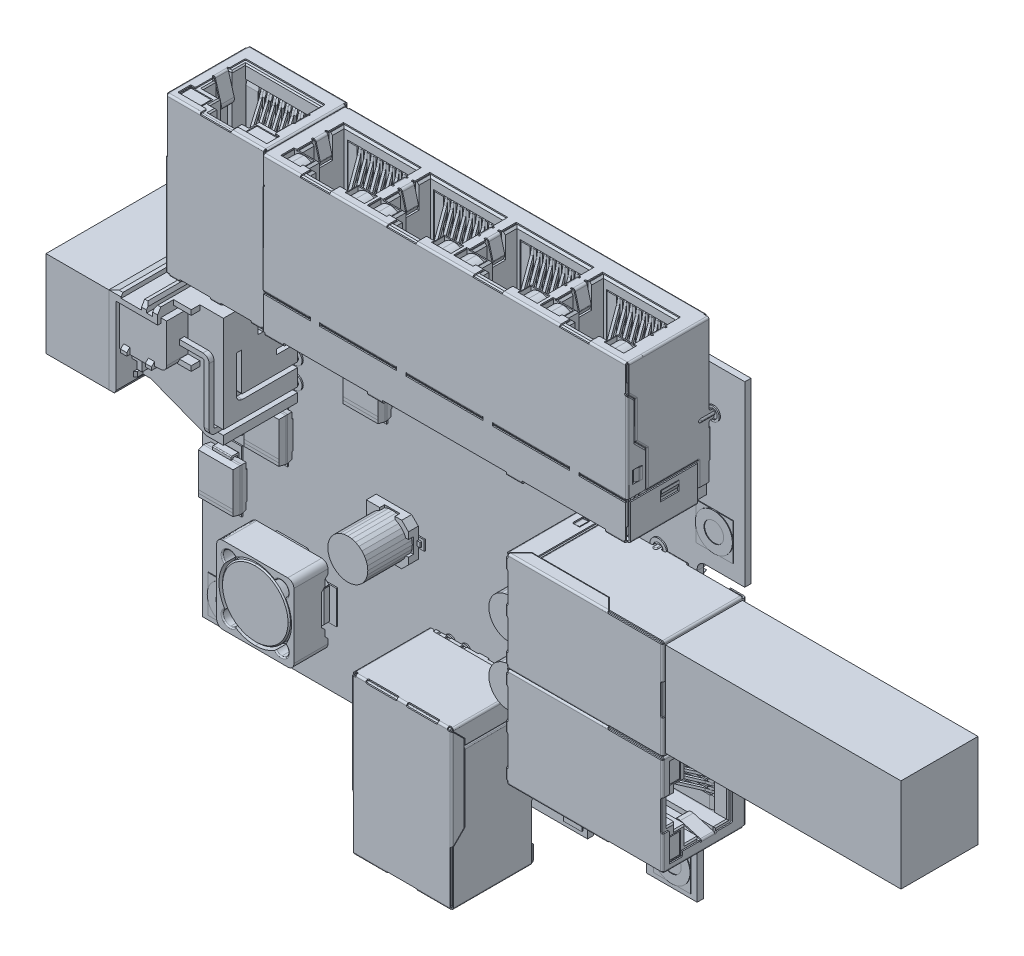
SolidWorks part; units mm, degrees
other "1[1]"
other "2[1]"
other "3[1]"
other "4[1]"
other "5[1]"
other "6[1]"
other "7[1]"
other "8[1]"
other "9[1]"
other "10[1]"
other "11[1]"
other "12[1]"
other "13[1]"
other "14[1]"
other "15[1]"
other "16[1]"
other "17[1]"
other "18[1]"
other "19[1]"
other "20[1]"
other "21[1]"
other "22[1]"
other "23[1]"
other "24[1]"
other "25[1]"
other "26[1]"
other "27[1]"
other "28[1]"
other "29[1]"
other "30[1]"
other "31[1]"
other "32[1]"
other "33[1]"
other "34[1]"
other "35[1]"
other "36[1]"
other "37[1]"
other "38[1]"
other "39[1]"
other "40[1]"
other "41[1]"
other "42[1]"
other "43[1]"
other "44[1]"
other "45[1]"
other "46[1]"
other "47[1]"
other "48[1]"
other "49[1]"
other "50[1]"
other "51[1]"
other "52[1]"
other "53[1]"
other "54[1]"
other "55[1]"
other "56[1]"
other "57[1]"
other "58[1]"
other "59[1]"
other "60[1]"
other "61[1]"
other "62[1]"
other "63[1]"
other "64[1]"
other "65[1]"
other "66[1]"
other "67[1]"
other "68[1]"
other "69[1]"
other "70[1]"
other "71[1]"
other "72[1]"
other "73[1]"
other "74[1]"
other "75[1]"
other "76[1]"
other "77[1]"
other "78[1]"
other "79[1]"
other "80[1]"
other "81[1]"
other "82[1]"
other "83[1]"
other "84[1]"
other "85[1]"
other "86[1]"
other "87[1]"
other "88[1]"
other "89[1]"
other "90[1]"
other "91[1]"
other "92[1]"
other "93[1]"
other "94[1]"
other "95[1]"
other "96[1]"
other "97[1]"
other "98[1]"
other "99[1]"
other "100[1]"
other "101[1]"
other "102[1]"
other "103[1]"
other "104[1]"
other "105[1]"
other "106[1]"
other "107[1]"
other "108[1]"
other "109[1]"
other "110[1]"
other "111[1]"
other "112[1]"
other "113[1]"
other "114[1]"
other "115[1]"
other "116[1]"
other "117[1]"
other "118[1]"
other "119[1]"
other "120[1]"
other "121[1]"
other "122[1]"
other "123[1]"
other "124[1]"
other "125[1]"
other "126[1]"
other "127[1]"
other "128[1]"
other "129[1]"
other "130[1]"
other "131[1]"
other "132[1]"
other "133[1]"
other "134[1]"
other "135[1]"
other "136[1]"
other "137[1]"
other "138[1]"
other "139[1]"
other "140[1]"
other "141[1]"
other "142[1]"
other "143[1]"
other "144[1]"
other "145[1]"
other "146[1]"
other "147[1]"
other "148[1]"
other "149[1]"
other "150[1]"
other "151[1]"
other "152[1]"
other "153[1]"
other "154[1]"
other "155[1]"
other "156[1]"
other "157[1]"
other "158[1]"
other "159[1]"
other "160[1]"
other "161[1]"
other "162[1]"
other "163[1]"
other "164[1]"
other "165[1]"
other "166[1]"
other "167[1]"
other "168[1]"
other "169[1]"
other "170[1]"
other "171[1]"
other "172[1]"
other "173[1]"
other "174[1]"
other "175[1]"
other "176[1]"
other "177[1]"
other "178[1]"
other "179[1]"
other "180[1]"
other "181[1]"
other "182[1]"
other "183[1]"
other "184[1]"
other "185[1]"
other "186[1]"
other "187[1]"
other "188[1]"
other "189[1]"
other "190[1]"
other "191[1]"
other "192[1]"
other "193[1]"
other "194[1]"
other "195[1]"
other "196[1]"
other "197[1]"
other "198[1]"
other "199[1]"
other "200[1]"
other "201[1]"
other "202[1]"
other "203[1]"
other "204[1]"
other "205[1]"
other "206[1]"
other "207[1]"
other "208[1]"
other "209[1]"
other "210[1]"
other "211[1]"
other "212[1]"
other "213[1]"
other "214[1]"
other "215[1]"
other "216[1]"
other "217[1]"
other "218[1]"
other "219[1]"
other "220[1]"
other "221[1]"
other "222[1]"
other "223[1]"
other "224[1]"
other "225[1]"
other "226[1]"
other "227[1]"
other "228[1]"
other "229[1]"
other "230[1]"
other "231[1]"
other "232[1]"
other "233[1]"
other "234[1]"
other "235[1]"
other "236[1]"
other "237[1]"
other "238[1]"
other "239[1]"
other "240[1]"
other "241[1]"
other "242[1]"
other "243[1]"
other "244[1]"
other "245[1]"
other "246[1]"
other "247[1]"
other "248[1]"
other "249[1]"
other "250[1]"
other "251[1]"
other "252[1]"
other "253[1]"
other "254[1]"
other "255[1]"
other "256[1]"
other "257[1]"
other "258[1]"
other "259[1]"
other "260[1]"
other "261[1]"
other "262[1]"
other "263[1]"
other "264[1]"
other "265[1]"
other "266[1]"
other "267[1]"
other "268[1]"
other "269[1]"
other "270[1]"
other "271[1]"
other "272[1]"
other "273[1]"
other "274[1]"
other "275[1]"
other "276[1]"
other "277[1]"
other "278[1]"
other "279[1]"
other "280[1]"
other "281[1]"
other "282[1]"
other "283[1]"
other "284[1]"
other "285[1]"
other "286[1]"
other "287[1]"
other "288[1]"
other "289[1]"
other "290[1]"
other "291[1]"
other "292[1]"
other "293[1]"
other "294[1]"
other "295[1]"
other "296[1]"
other "297[1]"
other "298[1]"
other "299[1]"
other "300[1]"
other "301[1]"
other "302[1]"
other "303[1]"
other "304[1]"
other "305[1]"
other "306[1]"
other "307[1]"
other "308[1]"
other "309[1]"
other "310[1]"
other "311[1]"
other "312[1]"
other "313[1]"
other "314[1]"
other "315[1]"
other "316[1]"
other "317[1]"
other "318[1]"
other "319[1]"
other "320[1]"
other "321[1]"
other "322[1]"
other "323[1]"
other "324[1]"
other "325[1]"
other "326[1]"
other "327[1]"
other "328[1]"
other "329[1]"
other "330[1]"
other "331[1]"
other "332[1]"
other "333[1]"
other "334[1]"
other "335[1]"
other "336[1]"
other "337[1]"
other "338[1]"
other "339[1]"
other "340[1]"
other "341[1]"
other "342[1]"
other "343[1]"
other "344[1]"
other "345[1]"
other "346[1]"
other "347[1]"
other "348[1]"
other "349[1]"
other "350[1]"
other "351[1]"
other "352[1]"
other "353[1]"
other "354[1]"
other "355[1]"
other "356[1]"
other "357[1]"
other "358[1]"
other "359[1]"
other "360[1]"
other "361[1]"
other "362[1]"
other "363[1]"
other "364[1]"
other "365[1]"
other "366[1]"
other "367[1]"
other "368[1]"
other "369[1]"
other "370[1]"
other "371[1]"
other "372[1]"
other "373[1]"
other "374[1]"
other "375[1]"
other "376[1]"
other "377[1]"
other "378[1]"
other "379[1]"
other "380[1]"
other "381[1]"
other "382[1]"
other "383[1]"
other "384[1]"
other "385[1]"
other "386[1]"
other "387[1]"
other "388[1]"
other "389[1]"
other "390[1]"
other "391[1]"
other "392[1]"
other "393[1]"
other "394[1]"
other "395[1]"
other "396[1]"
other "397[1]"
other "398[1]"
other "399[1]"
other "400[1]"
other "401[1]"
other "402[1]"
other "403[1]"
other "404[1]"
other "405[1]"
other "406[1]"
other "407[1]"
other "408[1]"
other "409[1]"
ref_plane "Front" through (0, 0, 0) normal (0, 0, 1) x (1, 0, 0)
ref_plane "Top" through (0, 0, 0) normal (0, 1, 0) x (1, 0, 0)
ref_plane "Right" through (0, 0, 0) normal (1, 0, 0) x (0, 0, -1)
imported_body "Imported1"
imported_body "Imported2"
imported_body "Imported3"
imported_body "Imported4"
imported_body "Imported5"
imported_body "Imported6"
imported_body "Imported7"
imported_body "Imported8"
imported_body "Imported9"
imported_body "Imported10"
imported_body "Imported11"
imported_body "Imported12"
imported_body "Imported13"
imported_body "Imported14"
imported_body "Imported15"
imported_body "Imported16"
imported_body "Imported17"
imported_body "Imported18"
imported_body "Imported19"
imported_body "Imported20"
imported_body "Imported21"
imported_body "Imported22"
imported_body "Imported23"
imported_body "Imported24"
imported_body "Imported25"
imported_body "Imported26"
imported_body "Imported27"
imported_body "Imported28"
imported_body "Imported29"
imported_body "Imported30"
imported_body "Imported31"
imported_body "Imported32"
imported_body "Imported33"
imported_body "Imported34"
imported_body "Imported35"
imported_body "Imported36"
imported_body "Imported37"
imported_body "Imported38"
imported_body "Imported39"
imported_body "Imported40"
imported_body "Imported41"
imported_body "Imported42"
imported_body "Imported43"
imported_body "Imported44"
imported_body "Imported45"
imported_body "Imported46"
imported_body "Imported47"
imported_body "Imported48"
imported_body "Imported49"
imported_body "Imported50"
imported_body "Imported51"
imported_body "Imported52"
imported_body "Imported53"
imported_body "Imported54"
imported_body "Imported55"
imported_body "Imported56"
imported_body "Imported57"
imported_body "Imported58"
imported_body "Imported59"
imported_body "Imported60"
imported_body "Imported61"
imported_body "Imported62"
imported_body "Imported63"
imported_body "Imported64"
imported_body "Imported65"
imported_body "Imported66"
imported_body "Imported67"
imported_body "Imported68"
imported_body "Imported69"
imported_body "Imported70"
imported_body "Imported71"
imported_body "Imported72"
imported_body "Imported73"
imported_body "Imported74"
imported_body "Imported75"
imported_body "Imported76"
imported_body "Imported77"
imported_body "Imported78"
imported_body "Imported79"
imported_body "Imported80"
imported_body "Imported81"
imported_body "Imported82"
imported_body "Imported83"
imported_body "Imported84"
imported_body "Imported85"
imported_body "Imported86"
imported_body "Imported87"
imported_body "Imported88"
imported_body "Imported89"
imported_body "Imported90"
imported_body "Imported91"
imported_body "Imported92"
imported_body "Imported93"
imported_body "Imported94"
imported_body "Imported95"
imported_body "Imported96"
imported_body "Imported97"
imported_body "Imported98"
imported_body "Imported99"
imported_body "Imported100"
imported_body "Imported101"
imported_body "Imported102"
imported_body "Imported103"
imported_body "Imported104"
imported_body "Imported105"
imported_body "Imported106"
imported_body "Imported107"
imported_body "Imported108"
imported_body "Imported109"
imported_body "Imported110"
imported_body "Imported111"
imported_body "Imported112"
imported_body "Imported113"
imported_body "Imported114"
imported_body "Imported115"
imported_body "Imported116"
imported_body "Imported117"
imported_body "Imported118"
imported_body "Imported119"
imported_body "Imported120"
imported_body "Imported121"
imported_body "Imported122"
imported_body "Imported123"
imported_body "Imported124"
imported_body "Imported125"
imported_body "Imported126"
imported_body "Imported127"
imported_body "Imported128"
imported_body "Imported129"
imported_body "Imported130"
imported_body "Imported131"
imported_body "Imported132"
imported_body "Imported133"
imported_body "Imported134"
imported_body "Imported135"
imported_body "Imported136"
imported_body "Imported137"
imported_body "Imported138"
imported_body "Imported139"
imported_body "Imported140"
imported_body "Imported141"
imported_body "Imported142"
imported_body "Imported143"
imported_body "Imported144"
imported_body "Imported145"
imported_body "Imported146"
imported_body "Imported147"
imported_body "Imported148"
imported_body "Imported149"
imported_body "Imported150"
imported_body "Imported151"
imported_body "Imported152"
imported_body "Imported153"
imported_body "Imported154"
imported_body "Imported155"
imported_body "Imported156"
imported_body "Imported157"
imported_body "Imported158"
imported_body "Imported159"
imported_body "Imported160"
imported_body "Imported161"
imported_body "Imported162"
imported_body "Imported163"
imported_body "Imported164"
imported_body "Imported165"
imported_body "Imported166"
imported_body "Imported167"
imported_body "Imported168"
imported_body "Imported169"
imported_body "Imported170"
imported_body "Imported171"
imported_body "Imported172"
imported_body "Imported173"
imported_body "Imported174"
imported_body "Imported175"
imported_body "Imported176"
imported_body "Imported177"
imported_body "Imported178"
imported_body "Imported179"
imported_body "Imported180"
imported_body "Imported181"
imported_body "Imported182"
imported_body "Imported183"
imported_body "Imported184"
imported_body "Imported185"
imported_body "Imported186"
imported_body "Imported187"
imported_body "Imported188"
imported_body "Imported189"
imported_body "Imported190"
imported_body "Imported191"
imported_body "Imported192"
imported_body "Imported193"
imported_body "Imported194"
imported_body "Imported195"
imported_body "Imported196"
imported_body "Imported197"
imported_body "Imported198"
imported_body "Imported199"
imported_body "Imported200"
imported_body "Imported201"
imported_body "Imported202"
imported_body "Imported203"
imported_body "Imported204"
imported_body "Imported205"
imported_body "Imported206"
imported_body "Imported207"
imported_body "Imported208"
imported_body "Imported209"
imported_body "Imported210"
imported_body "Imported211"
imported_body "Imported212"
imported_body "Imported213"
imported_body "Imported214"
imported_body "Imported215"
imported_body "Imported216"
imported_body "Imported217"
imported_body "Imported218"
imported_body "Imported219"
imported_body "Imported220"
imported_body "Imported221"
imported_body "Imported222"
imported_body "Imported223"
imported_body "Imported224"
imported_body "Imported225"
imported_body "Imported226"
imported_body "Imported227"
imported_body "Imported228"
imported_body "Imported229"
imported_body "Imported230"
imported_body "Imported231"
imported_body "Imported232"
imported_body "Imported233"
imported_body "Imported234"
imported_body "Imported235"
imported_body "Imported236"
imported_body "Imported237"
imported_body "Imported238"
imported_body "Imported239"
imported_body "Imported240"
imported_body "Imported241"
imported_body "Imported242"
imported_body "Imported243"
imported_body "Imported244"
imported_body "Imported245"
imported_body "Imported246"
imported_body "Imported247"
imported_body "Imported248"
imported_body "Imported249"
imported_body "Imported250"
imported_body "Imported251"
imported_body "Imported252"
imported_body "Imported253"
imported_body "Imported254"
imported_body "Imported255"
imported_body "Imported256"
imported_body "Imported257"
imported_body "Imported258"
imported_body "Imported259"
imported_body "Imported260"
imported_body "Imported261"
imported_body "Imported262"
imported_body "Imported263"
imported_body "Imported264"
imported_body "Imported265"
imported_body "Imported266"
imported_body "Imported267"
imported_body "Imported268"
imported_body "Imported269"
imported_body "Imported270"
imported_body "Imported271"
imported_body "Imported272"
imported_body "Imported273"
imported_body "Imported274"
imported_body "Imported275"
imported_body "Imported276"
imported_body "Imported277"
imported_body "Imported278"
imported_body "Imported279"
imported_body "Imported280"
imported_body "Imported281"
imported_body "Imported282"
imported_body "Imported283"
imported_body "Imported284"
imported_body "Imported285"
imported_body "Imported286"
imported_body "Imported287"
imported_body "Imported288"
imported_body "Imported289"
imported_body "Imported290"
imported_body "Imported291"
imported_body "Imported292"
imported_body "Imported293"
imported_body "Imported294"
imported_body "Imported295"
imported_body "Imported296"
imported_body "Imported297"
imported_body "Imported298"
imported_body "Imported299"
imported_body "Imported300"
imported_body "Imported301"
imported_body "Imported302"
imported_body "Imported303"
imported_body "Imported304"
imported_body "Imported305"
imported_body "Imported306"
imported_body "Imported307"
imported_body "Imported308"
imported_body "Imported309"
imported_body "Imported310"
imported_body "Imported311"
imported_body "Imported312"
imported_body "Imported313"
imported_body "Imported314"
imported_body "Imported315"
imported_body "Imported316"
imported_body "Imported317"
imported_body "Imported318"
imported_body "Imported319"
imported_body "Imported320"
imported_body "Imported321"
imported_body "Imported322"
imported_body "Imported323"
imported_body "Imported324"
imported_body "Imported325"
imported_body "Imported326"
imported_body "Imported327"
imported_body "Imported328"
imported_body "Imported329"
imported_body "Imported330"
imported_body "Imported331"
imported_body "Imported332"
imported_body "Imported333"
imported_body "Imported334"
imported_body "Imported335"
imported_body "Imported336"
imported_body "Imported337"
imported_body "Imported338"
imported_body "Imported339"
imported_body "Imported340"
imported_body "Imported341"
imported_body "Imported342"
imported_body "Imported343"
imported_body "Imported344"
imported_body "Imported345"
imported_body "Imported346"
imported_body "Imported347"
imported_body "Imported348"
imported_body "Imported349"
imported_body "Imported350"
imported_body "Imported351"
imported_body "Imported352"
imported_body "Imported353"
imported_body "Imported354"
imported_body "Imported355"
imported_body "Imported356"
imported_body "Imported357"
imported_body "Imported358"
imported_body "Imported359"
imported_body "Imported360"
imported_body "Imported361"
imported_body "Imported362"
imported_body "Imported363"
imported_body "Imported364"
imported_body "Imported365"
imported_body "Imported366"
imported_body "Imported367"
imported_body "Imported368"
imported_body "Imported369"
imported_body "Imported370"
imported_body "Imported371"
imported_body "Imported372"
imported_body "Imported373"
imported_body "Imported374"
imported_body "Imported375"
imported_body "Imported376"
imported_body "Imported377"
imported_body "Imported378"
imported_body "Imported379"
imported_body "Imported380"
imported_body "Imported381"
imported_body "Imported382"
imported_body "Imported383"
imported_body "Imported384"
imported_body "Imported385"
imported_body "Imported386"
imported_body "Imported387"
imported_body "Imported388"
imported_body "Imported389"
imported_body "Imported390"
imported_body "Imported391"
imported_body "Imported392"
imported_body "Imported393"
imported_body "Imported394"
imported_body "Imported395"
imported_body "Imported396"
imported_body "Imported397"
imported_body "Imported398"
imported_body "Imported399"
imported_body "Imported400"
imported_body "Imported401"
imported_body "Imported402"
imported_body "Imported403"
imported_body "Imported404"
imported_body "Imported405"
imported_body "Imported406"
imported_body "Imported407"
imported_body "Imported408"
imported_body "Imported409"
sketch "Sketch1" plane through (-41.953, 0, 0) normal (-1, 0, 0) x (0, 0, 1)
  line L4 (18.25, 16.8768) -> (-1.7, 16.8768)
  line L5 (-1.7, 16.8768) -> (-1.7, 2.8768)
  line L6 (-1.7, 2.8768) -> (18.25, 2.8768)
  line L7 (18.25, 2.8768) -> (18.25, 16.8768)
  line L8 (18.25, 16.8768) -> (-1.7, 16.8768)
  line L9 (-1.7, 16.8768) -> (-1.7, 2.8768)
  line L10 (-1.7, 2.8768) -> (18.25, 2.8768)
  line L11 (18.25, 2.8768) -> (18.25, 16.8768)
  dimension "D1" = 0
extrude "Boss-Extrude1" add sketch "Sketch1" along normal blind 10.16 separate body
sketch "Sketch2" plane through (43.8921, 0, 0) normal (1, 0, 0) x (0, 0, -1)
  line L4 (-14.08, -7.173) -> (-1.62, -7.173)
  line L5 (-1.62, -7.173) -> (-1.62, 7.987)
  line L6 (-1.62, 7.987) -> (-14.08, 7.987)
  line L7 (-14.08, 7.987) -> (-14.08, -7.173)
  line L8 (-14.08, -7.173) -> (-1.62, -7.173)
  line L9 (-1.62, -7.173) -> (-1.62, 7.987)
  line L10 (-1.62, 7.987) -> (-14.08, 7.987)
  line L11 (-14.08, 7.987) -> (-14.08, -7.173)
  dimension "D1" = 0
extrude "Boss-Extrude2" add sketch "Sketch2" along normal blind 38.1
